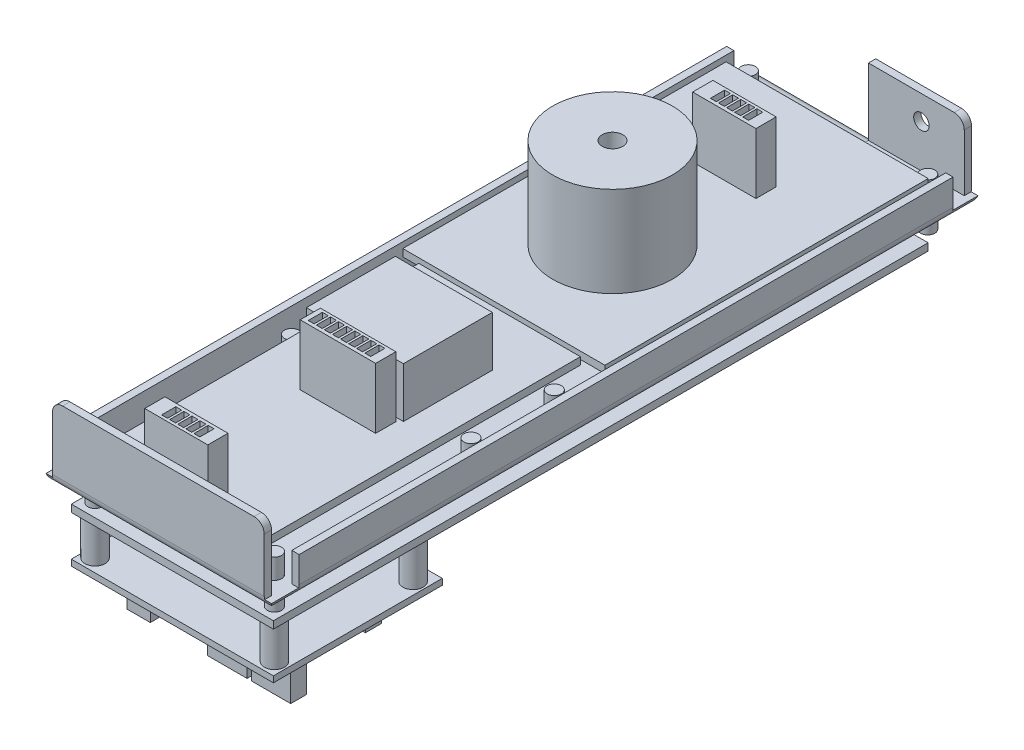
SolidWorks part; units mm, degrees
ref_plane "Front" through (0, 0, 0) normal (0, 0, 1) x (1, 0, 0)
ref_plane "Top" through (0, 0, 0) normal (0, 1, 0) x (1, 0, 0)
ref_plane "Right" through (0, 0, 0) normal (1, 0, 0) x (0, 0, -1)
sketch "Sketch1" plane through (0, 0, 0) normal (0, 1, 0) x (1, 0, 0)
  line L0 (0, 108.0188) -> (0, -114.9389) construction
  line L1 (-35.56, 115.5287) -> (35.56, 115.5287)
  line L2 (-35.56, 115.5287) -> (-35.56, -106.7213)
  line L3 (-35.56, -106.7213) -> (35.56, -106.7213)
  line L5 (35.56, 115.5287) -> (35.56, -106.7213)
  dimension "D1" = 222.25
  dimension "D2" = 71.12
extrude "Extrude1" add sketch "Sketch1" along normal blind 2.286
sketch "Sketch2" plane through (0, 2.286, 0) normal (0, 1, 0) x (-1, 0, 0)
  line L1 (-33.274, 104.4353) -> (33.274, 104.4353)
  line L2 (-33.274, 104.4353) -> (-33.274, 106.7213)
  line L3 (-33.274, 106.7213) -> (33.274, 106.7213)
  line L4 (33.274, 104.4353) -> (33.274, 106.7213)
  line L5 (35.56, -115.5287) -> (35.56, 106.7213) construction
  line L6 (-35.56, 106.7213) -> (-35.56, -115.5287) construction
  dimension "D1" = 2.286
  dimension "D2" = 2.286
  dimension "D3" = 2.286
extrude "Extrude2" add sketch "Sketch2" along normal blind 21.082
fillet "Fillet2" radius 3.175 1 edges at (-33.274, 23.368, 105.5783)
fillet "Fillet3" radius 3.175 1 edges at (33.274, 23.368, 105.5783)
sketch "Sketch4" plane through (0, 0, -115.5287) normal (0, 0, -1) x (-1, 0, 0)
  line L1 (0, -7.8455) -> (0, 25.2472) construction
  line L3 (-33.274, 20.193) -> (-33.274, 2.286) construction
  line L4 (-30.099, 23.368) -> (30.099, 23.368) construction
  line L7 (-33.274, 2.286) -> (-33.274, 0)
  line L8 (-33.274, 20.193) -> (-33.274, 2.286)
  line L9 (-30.099, 23.368) -> (-3.175, 23.368)
  line L11 (-38.8753, 0) -> (47.0509, 0) construction
  line L12 (-33.274, 0) -> (-3.175, 0)
  line L13 (-3.175, 0) -> (-3.175, 23.368)
  line L14 (1.5875, 2.286) -> (1.5875, -12.573)
  line L15 (-35.56, 2.286) -> (35.56, 2.286) construction
  line L16 (1.5875, -12.573) -> (26.924, -12.573)
  line L17 (33.274, -6.223) -> (33.274, 2.286)
  line L18 (33.274, 2.286) -> (1.5875, 2.286)
  arc A0 (-30.099, 23.368) -> (-33.274, 20.193) centre (-30.099, 20.193) ccw construction
  arc A1 (-30.099, 23.368) -> (-33.274, 20.193) centre (-30.099, 20.193) ccw
  arc A2 (26.924, -12.573) -> (33.274, -6.223) centre (26.924, -6.223) ccw
  dimension "D1" = 3.175
  dimension "D2" = 6.35
  dimension "D3" = 3.175
  dimension "D4" = 14.859
extrude "Extrude3" add sketch "Sketch4" against normal blind 2.286
sketch "Sketch5" plane through (0, 2.286, 0) normal (0, 1, 0) x (-1, 0, 0)
  line L0 (-35.56, 106.7213) -> (-35.56, -115.5287) construction
  line L1 (-35.56, 98.0439) -> (-33.274, 98.0439)
  line L2 (-35.56, 98.0439) -> (-35.56, -107.4247)
  line L3 (-35.56, -107.4247) -> (-33.274, -107.4247)
  line L4 (-33.274, 98.0439) -> (-33.274, -107.4247)
  line L5 (0, -123.2887) -> (0, 116.775) construction
  line L6 (33.274, 98.0439) -> (33.274, -107.4247)
  line L7 (35.56, -107.4247) -> (33.274, -107.4247)
  line L8 (35.56, 98.0439) -> (35.56, -107.4247)
  line L9 (35.56, 98.0439) -> (33.274, 98.0439)
  dimension "D1" = 2.286
extrude "Extrude4" add sketch "Sketch5" along normal blind 9.144
fillet "Fillet5" radius 3.175 1 edges at (-16.1925, 2.286, -115.5287)
fillet "Fillet6" radius 3.175 1 edges at (19.3675, 0, -115.5287)
fillet "Fillet7" radius 3.175 1 edges at (0, 0, 106.7213)
fillet "Fillet8" radius 3.175 2 edges at (35.56, 0, -4.4037) (-35.56, 0, -4.4037)
sketch "Sketch6" plane through (0, 0, 0) normal (0, -1, 0) x (1, 0, 0)
  circle A0 centre (28.0011, 98.235) radius 2.2331
  circle A1 centre (-28.3833, 98.235) radius 2.2331
  circle A2 centre (28.0011, -107.0424) radius 2.2331
  circle A3 centre (-28.3833, -107.0424) radius 2.2331
extrude "Extrude5" add sketch "Sketch6" along normal blind 6.35
sketch "Sketch7" plane through (0, -6.35, 0) normal (0, -1, 0) x (1, 0, 0)
  line L0 (-1.5875, -113.2427) -> (-26.924, -113.2427) construction
  line L1 (0, -127.3835) -> (0, 116.114) construction
  line L2 (-31.75, 102.3271) -> (31.75, 102.3271)
  line L3 (-31.75, 102.3271) -> (-31.75, -103.4129)
  line L4 (-31.75, -103.4129) -> (31.75, -103.4129)
  line L6 (31.75, 102.3271) -> (31.75, -103.4129)
  point P9 (0, 102.3271)
  dimension "D1" = 205.74
  dimension "D2" = 63.5
  dimension "D3" = 9.8298
extrude "Extrude6" add sketch "Sketch7" along normal blind 2.286
sketch "Sketch8" plane through (0, 2.286, 0) normal (0, 1, 0) x (-1, 0, 0)
  circle A0 centre (28.3833, 98.235) radius 2.2331 construction
  circle A1 centre (-28.0011, 98.235) radius 2.2331 construction
  circle A2 centre (28.3833, -107.0424) radius 2.2331 construction
  circle A3 centre (-28.0011, -107.0424) radius 2.2331 construction
  circle A4 centre (28.3833, 98.235) radius 2.2331
  circle A5 centre (-28.0011, 98.235) radius 2.2331
  circle A6 centre (28.3833, -107.0424) radius 2.2331
  circle A7 centre (-28.0011, -107.0424) radius 2.2331
  circle A8 centre (28.3833, 10.3136) radius 2.2331
  circle A9 centre (-28.0011, 10.3136) radius 2.2331
  circle A10 centre (-28.0011, 36.4988) radius 2.2331
  circle A11 centre (28.3833, 36.4988) radius 2.2331
extrude "Extrude7" add sketch "Sketch8" along normal blind 6.35
sketch "Sketch10" plane through (0, 8.636, 0) normal (0, 1, 0) x (-1, 0, 0)
  line L8 (0, 117.5913) -> (0, -123.4442) construction
  line L10 (-25.4, 101.0955) -> (25.4, 101.0955)
  line L11 (-31.5598, -2.0285) -> (31.9402, -2.0285)
  line L12 (-25.4, 101.0955) -> (-25.4, -0.5045)
  line L13 (-31.5598, -2.0285) -> (-31.5598, -103.6285)
  line L14 (-31.5598, -103.6285) -> (31.9402, -103.6285)
  line L15 (31.9402, -2.0285) -> (31.9402, -103.6285)
  line L17 (-25.4, -0.5045) -> (25.4, -0.5045)
  line L18 (25.4, 101.0955) -> (25.4, -0.5045)
  point P9 (0, 101.0955)
  point P11 (0.1902, -2.0285)
  dimension "D1" = 50.8
  dimension "D2" = 101.6
  dimension "D3" = 101.6
  dimension "D4" = 63.5
  dimension "D5" = 1.524
extrude "Extrude9" add sketch "Sketch10" along normal blind 2.286
sketch "Sketch12" plane through (0, 10.922, 0) normal (0, 1, 0) x (-1, 0, 0)
  line L1 (-15.24, 44.9606) -> (15.24, 44.9606)
  line L2 (-15.24, 44.9606) -> (-15.24, 17.0206)
  line L3 (-15.24, 17.0206) -> (15.24, 17.0206)
  line L4 (15.24, 44.9606) -> (15.24, 17.0206)
  point P4 (0, 17.0206)
  dimension "D1" = 27.94
  dimension "D2" = 30.48
extrude "Extrude11" add sketch "Sketch12" along normal blind 15.748
sketch "Sketch13" plane through (0, 10.922, 0) normal (0, 1, 0) x (-1, 0, 0)
  circle A0 centre (0, -35.9852) radius 18.796
  circle A1 centre (0, -35.9852) radius 3.211
  dimension "D1" = 37.592
extrude "Extrude12" add sketch "Sketch13" along normal blind 28.3845
sketch "Sketch14" plane through (0, 10.922, 0) normal (0, 1, 0) x (-1, 0, 0)
  line L0 (25.4, 101.0955) -> (-25.4, 101.0955) construction
  line L1 (-9.906, 94.7455) -> (9.906, 94.7455)
  line L2 (-9.906, 94.7455) -> (-9.906, 101.0955)
  line L3 (-9.906, 101.0955) -> (9.906, 101.0955)
  line L4 (9.906, 94.7455) -> (9.906, 101.0955)
  line L5 (-31.5598, -103.6285) -> (31.9402, -103.6285) construction
  line L6 (-14.0977, 52.5374) -> (9.6259, 52.5374)
  line L7 (-14.0977, 52.5374) -> (-14.0977, 46.1874)
  line L8 (-14.0977, 46.1874) -> (9.6259, 46.1874)
  line L9 (9.6259, 52.5374) -> (9.6259, 46.1874)
  line L10 (-9.9378, -71.1165) -> (9.9378, -71.1165)
  line L11 (-9.9378, -71.1165) -> (-9.9377, -77.4665)
  line L12 (-9.9377, -77.4665) -> (9.9377, -77.4665)
  line L13 (9.9378, -71.1165) -> (9.9377, -77.4665)
  line L14 (-3.9661, 100.1852) -> (-2.1089, 100.1852)
  line L15 (-6.5061, 100.1852) -> (-4.6489, 100.1852)
  line L16 (-6.5061, 100.1852) -> (-6.5061, 95.7278)
  line L17 (-6.5061, 95.7278) -> (-4.6489, 95.7278)
  line L18 (-4.6489, 100.1852) -> (-4.6489, 95.7278)
  line L19 (-3.9661, 100.1852) -> (-3.9661, 95.7278)
  line L20 (-3.9661, 95.7278) -> (-2.1089, 95.7278)
  line L21 (-2.1089, 100.1852) -> (-2.1089, 95.7278)
  line L22 (-1.4261, 100.1852) -> (0.4311, 100.1852)
  line L23 (-1.4261, 100.1852) -> (-1.4261, 95.7278)
  line L24 (-1.4261, 95.7278) -> (0.4311, 95.7278)
  line L25 (0.4311, 100.1852) -> (0.4311, 95.7278)
  line L26 (1.1139, 100.1852) -> (2.9711, 100.1852)
  line L27 (1.1139, 100.1852) -> (1.1139, 95.7278)
  line L28 (1.1139, 95.7278) -> (2.9711, 95.7278)
  line L29 (2.9711, 100.1852) -> (2.9711, 95.7278)
  line L30 (3.6539, 100.1852) -> (5.5111, 100.1852)
  line L31 (3.6539, 100.1852) -> (3.6539, 95.7278)
  line L32 (3.6539, 95.7278) -> (5.5111, 95.7278)
  line L33 (5.5111, 100.1852) -> (5.5111, 95.7278)
  line L34 (-8.924, 51.4526) -> (-7.0668, 51.4526)
  line L35 (-11.464, 51.4526) -> (-9.6068, 51.4526)
  line L36 (-11.464, 51.4526) -> (-11.464, 46.9952)
  line L37 (-11.464, 46.9952) -> (-9.6068, 46.9952)
  line L38 (-9.6068, 51.4526) -> (-9.6068, 46.9952)
  line L39 (-8.924, 51.4526) -> (-8.924, 46.9952)
  line L40 (-8.924, 46.9952) -> (-7.0668, 46.9952)
  line L41 (-7.0668, 51.4526) -> (-7.0668, 46.9952)
  line L42 (-6.384, 51.4526) -> (-4.5268, 51.4526)
  line L43 (-6.384, 51.4526) -> (-6.384, 46.9952)
  line L44 (-6.384, 46.9952) -> (-4.5268, 46.9952)
  line L45 (-4.5268, 51.4526) -> (-4.5268, 46.9952)
  line L46 (-3.844, 51.4526) -> (-1.9868, 51.4526)
  line L47 (-3.844, 51.4526) -> (-3.844, 46.9952)
  line L48 (-3.844, 46.9952) -> (-1.9868, 46.9952)
  line L49 (-1.9868, 51.4526) -> (-1.9868, 46.9952)
  line L50 (-1.304, 51.4526) -> (0.5532, 51.4526)
  line L51 (-1.304, 51.4526) -> (-1.304, 46.9952)
  line L52 (-1.304, 46.9952) -> (0.5532, 46.9952)
  line L53 (0.5532, 51.4526) -> (0.5532, 46.9952)
  line L54 (1.236, 51.4526) -> (3.0932, 51.4526)
  line L55 (1.236, 51.4526) -> (1.236, 46.9952)
  line L56 (1.236, 46.9952) -> (3.0932, 46.9952)
  line L57 (3.0932, 51.4526) -> (3.0932, 46.9952)
  line L58 (3.776, 51.4526) -> (5.6332, 51.4526)
  line L59 (3.776, 51.4526) -> (3.776, 46.9952)
  line L60 (3.776, 46.9952) -> (5.6332, 46.9952)
  line L61 (5.6332, 51.4526) -> (5.6332, 46.9952)
  line L62 (6.316, 51.4526) -> (8.1732, 51.4526)
  line L63 (6.316, 51.4526) -> (6.316, 46.9952)
  line L64 (6.316, 46.9952) -> (8.1732, 46.9952)
  line L65 (8.1732, 51.4526) -> (8.1732, 46.9952)
  line L66 (-4.0286, -72.1924) -> (-2.1714, -72.1924)
  line L67 (-6.5686, -72.1924) -> (-4.7114, -72.1924)
  line L68 (-6.5686, -72.1924) -> (-6.5686, -76.6498)
  line L69 (-6.5686, -76.6498) -> (-4.7114, -76.6498)
  line L70 (-4.7114, -72.1924) -> (-4.7114, -76.6498)
  line L71 (-4.0286, -72.1924) -> (-4.0286, -76.6498)
  line L72 (-4.0286, -76.6498) -> (-2.1714, -76.6498)
  line L73 (-2.1714, -72.1924) -> (-2.1714, -76.6498)
  line L74 (-1.4886, -72.1924) -> (0.3686, -72.1924)
  line L75 (-1.4886, -72.1924) -> (-1.4886, -76.6498)
  line L76 (-1.4886, -76.6498) -> (0.3686, -76.6498)
  line L77 (0.3686, -72.1924) -> (0.3686, -76.6498)
  line L78 (1.0514, -72.1924) -> (2.9086, -72.1924)
  line L79 (1.0514, -72.1924) -> (1.0514, -76.6498)
  line L80 (1.0514, -76.6498) -> (2.9086, -76.6498)
  line L81 (2.9086, -72.1924) -> (2.9086, -76.6498)
  line L82 (3.5914, -72.1924) -> (5.4486, -72.1924)
  line L83 (3.5914, -72.1924) -> (3.5914, -76.6498)
  line L84 (3.5914, -76.6498) -> (5.4486, -76.6498)
  line L85 (5.4486, -72.1924) -> (5.4486, -76.6498)
  point P6 (0, 94.7455)
  point P15 (0, -71.1165)
  point P22 (-4.9579, 46.0129)
  dimension "D1" = 19.812
  dimension "D2" = 6.35
  dimension "D3" = 6.35
  dimension "D4" = 23.7236
  dimension "D5" = 6.35
  dimension "D6" = 19.8755
  dimension "D7" = 26.162
extrude "Extrude13" add sketch "Sketch14" along normal blind 19.05 separate body
sketch "Sketch15" plane through (0, -8.636, 0) normal (0, -1, 0) x (1, 0, 0)
  circle A0 centre (28.0011, 98.235) radius 3.175
  circle A1 centre (-28.3833, 98.235) radius 3.175
  circle A2 centre (28.0011, 54.6726) radius 3.175
  circle A3 centre (-28.3833, 54.6726) radius 3.175
  dimension "D1" = 6.35
extrude "Extrude14" add sketch "Sketch15" along normal blind 12.7
sketch "Sketch16" plane through (0, -21.336, 0) normal (0, -1, 0) x (1, 0, 0)
  line L0 (-31.75, 102.3271) -> (-31.75, -103.4129) construction
  line L1 (31.75, 102.3271) -> (-31.75, 102.3271)
  line L2 (31.75, 102.3271) -> (31.75, 49.2596)
  line L3 (31.75, 49.2596) -> (-31.75, 49.2596)
  line L4 (-31.75, 102.3271) -> (-31.75, 49.2596)
extrude "Extrude15" add sketch "Sketch16" along normal blind 1.905
sketch "Sketch17" plane through (0, -23.241, 0) normal (0, -1, 0) x (1, 0, 0)
  line L1 (19.05, 87.0871) -> (9.271, 87.0871)
  line L2 (19.05, 87.0871) -> (19.05, 66.1321)
  line L3 (19.05, 66.1321) -> (9.271, 66.1321)
  line L4 (9.271, 87.0871) -> (9.271, 66.1321)
  dimension "D1" = 9.779
  dimension "D2" = 20.955
  dimension "D3" = 12.7
  dimension "D4" = 15.24
extrude "Extrude16" add sketch "Sketch17" along normal blind 8.382
sketch "Sketch18" plane through (0, -23.241, 0) normal (0, -1, 0) x (1, 0, 0)
  line L1 (27.9809, 93.113) -> (15.5857, 93.113)
  line L2 (27.9809, 93.113) -> (27.9809, 88.0838)
  line L3 (27.9809, 88.0838) -> (15.5857, 88.0838)
  line L4 (15.5857, 93.113) -> (15.5857, 88.0838)
  line L5 (14.2791, 93.113) -> (1.8839, 93.113)
  line L6 (14.2791, 93.113) -> (14.2791, 88.0838)
  line L7 (14.2791, 88.0838) -> (1.8839, 88.0838)
  line L8 (1.8839, 93.113) -> (1.8839, 88.0838)
  line L9 (-16.1456, 93.113) -> (-23.4862, 93.113)
  line L10 (-16.1456, 93.113) -> (-16.1456, 88.0838)
  line L11 (-16.1456, 88.0838) -> (-23.4862, 88.0838)
  line L12 (-23.4862, 93.113) -> (-23.4862, 88.0838)
  line L13 (20.4387, 62.1283) -> (8.0435, 62.1283)
  line L14 (20.4387, 62.1283) -> (20.4387, 57.0991)
  line L15 (20.4387, 57.0991) -> (8.0435, 57.0991)
  line L16 (8.0435, 62.1283) -> (8.0435, 57.0991)
  line L17 (-3.2665, 81.1671) -> (-12.4126, 81.1671)
  line L18 (-3.2665, 81.1671) -> (-3.2665, 76.1379)
  line L19 (-3.2665, 76.1379) -> (-12.4126, 76.1379)
  line L20 (-12.4126, 81.1671) -> (-12.4126, 76.1379)
  dimension "D1" = 5.0292
  dimension "D2" = 12.3952
  dimension "D3" = 7.3406
extrude "Extrude17" add sketch "Sketch18" along normal blind 12.1539
sketch "Sketch19" plane through (0, -23.241, 0) normal (0, -1, 0) x (1, 0, 0)
  line L1 (-15.7723, 81.1776) -> (-27.9049, 81.1776)
  line L2 (-15.7723, 81.1776) -> (-15.7723, 76.1379)
  line L3 (-15.7723, 76.1379) -> (-27.9049, 76.1379)
  line L4 (-27.9049, 81.1776) -> (-27.9049, 76.1379)
extrude "Extrude18" add sketch "Sketch19" along normal blind 3.048
sketch "Sketch20" plane through (0, -26.289, 0) normal (0, -1, 0) x (1, 0, 0)
  line L0 (-27.9049, 81.1776) -> (-27.9049, 76.1379) construction
  line L1 (-15.7723, 76.1379) -> (-27.9049, 76.1379)
  line L2 (-15.7723, 76.1379) -> (-15.7723, 77.4445)
  line L3 (-15.7723, 77.4445) -> (-27.9049, 77.4445)
  line L4 (-27.9049, 76.1379) -> (-27.9049, 77.4445)
extrude "Extrude19" add sketch "Sketch20" along normal blind 9.1948
hole_wizard "#11 (0.191) Diameter Hole1" positions "Sketch22" profile "Sketch21" hole size "#11" standard "Ansi Inch"
sketch "Sketch22" plane through (0, 0, -115.5287) normal (0, 0, -1) x (-1, 0, 0)
  line L1 (1.5875, -12.573) -> (26.924, -12.573) construction
  line L2 (-3.175, 23.368) -> (-30.099, 23.368) construction
  point P0 (19.812, -4.953)
  point P1 (-19.812, 15.748)
  dimension "D1" = 19.812
  dimension "D2" = 7.62
  dimension "D3" = 7.62
  dimension "D4" = 19.812
sketch "Sketch21" plane through (-19.812, -4.953, -115.5287) normal (1, 0, 0) x (0, 1, 0)
  line L0 (0, 0) -> (0, 2.286)
  line L1 (0, 2.286) -> (2.4257, 2.286)
  line L2 (2.4257, 2.286) -> (2.4257, 0)
  line L5 (2.4257, 0) -> (0, 0)
  line L11 (0, -6.35) -> (0, 107.95) construction
  dimension "Thru Hole Dia." = 4.8514
  dimension "Thru Hole Depth" = 2.286
